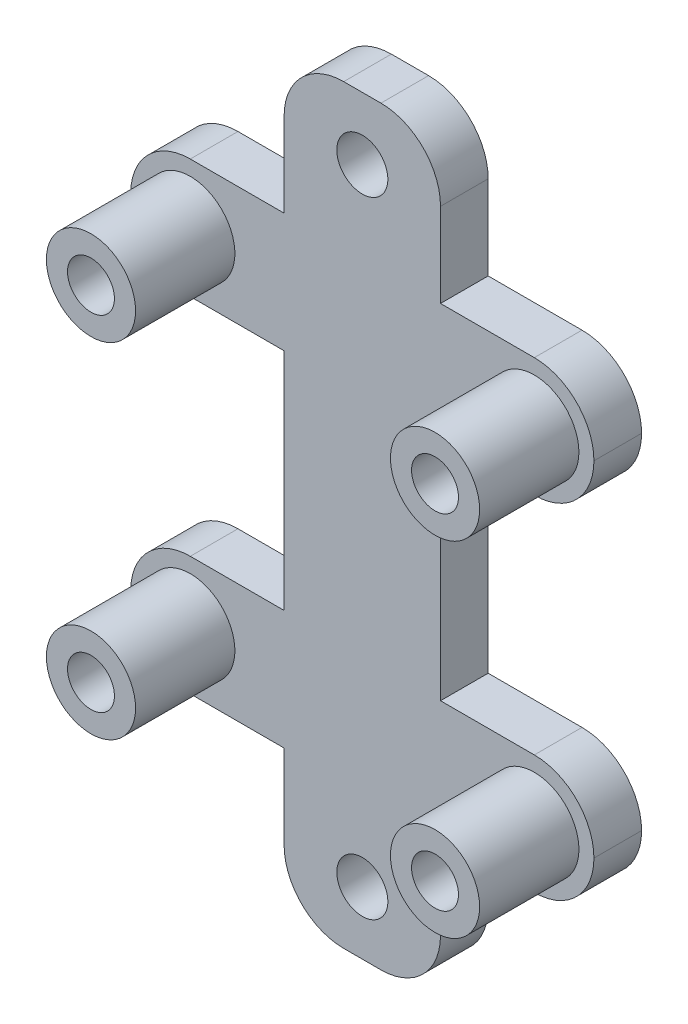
SolidWorks part; units mm, degrees
ref_plane "Front Plane" through (0, 0, 0) normal (0, 0, 1) x (1, 0, 0)
ref_plane "Top Plane" through (0, 0, 0) normal (0, 1, 0) x (1, 0, 0)
ref_plane "Right Plane" through (0, 0, 0) normal (1, 0, 0) x (0, 0, -1)
sketch "Sketch1" plane through (0, 0, 0) normal (0, 0, 1) x (1, 0, 0)
  line L0 (29.62, 30.6567) -> (19.81, 30.6567)
  line L5 (19.81, 30.6567) -> (19.81, 39.8467)
  line L6 (19.81, 39.8467) -> (9.81, 39.8467)
  line L7 (9.81, 39.8467) -> (9.81, 30.6567)
  line L8 (0, 30.6567) -> (9.81, 30.6567)
  line L14 (0, 15.8467) -> (29.62, 15.8467) construction
  line L16 (14.81, 15.8467) -> (14.81, 35.8467) construction
  line L17 (0, 30.6567) -> (0, 23.0367)
  line L18 (0, 23.0367) -> (9.81, 23.0367)
  line L22 (29.62, 30.6567) -> (29.62, 23.0367)
  line L23 (29.62, 23.0367) -> (19.81, 23.0367)
  line L27 (3.81, 26.8467) -> (14.81, 26.8467) construction
  line L28 (14.81, 26.8467) -> (25.81, 26.8467) construction
  line L29 (3.81, 26.8467) -> (3.81, 15.8467) construction
  line L31 (14.81, 35.8467) -> (14.81, 39.8467) construction
  line L32 (25.81, 26.8467) -> (25.81, 30.6567) construction
  line L33 (9.81, 23.0367) -> (9.81, 15.8467)
  line L34 (25.81, 26.8467) -> (25.81, 23.0367) construction
  line L35 (25.81, 26.8467) -> (29.62, 26.8467) construction
  line L36 (9.81, 15.8467) -> (19.81, 15.8467)
  line L37 (19.81, 15.8467) -> (19.81, 23.0367)
  circle A0 centre (14.81, 35.8467) radius 1.6319
  circle A3 centre (3.81, 26.8467) radius 1.5
  circle A4 centre (25.81, 26.8467) radius 1.5
  circle A7 centre (3.81, 26.8467) radius 3.81 construction
  dimension "D7" = 3.2639
  dimension "D8" = 3
  dimension "D2" = 7.62
  dimension "D1" = 24
  dimension "D3" = 5
  dimension "D4" = 11
  dimension "D5" = 11
  dimension "D6" = 20
extrude "Boss-Extrude1" add sketch "Sketch1" along normal blind 3.048
mirror "Mirror2" about plane through (9.81, 15.8467, 3.048) normal (0, 1, 0) of "Boss-Extrude1"
sketch "Sketch2" plane through (0, 0, 3.048) normal (0, 0, 1) x (1, 0, 0)
  circle A0 centre (3.81, 26.8467) radius 2.85
  circle A1 centre (25.81, 26.8467) radius 2.85
  circle A4 centre (3.81, 26.8467) radius 1.5
  circle A5 centre (25.81, 26.8467) radius 1.5
  circle A8 centre (3.81, 4.8467) radius 2.85
  circle A9 centre (25.81, 4.8467) radius 2.85
  circle A10 centre (25.81, 4.8467) radius 1.5
  circle A11 centre (3.81, 4.8467) radius 1.5
  dimension "D2" = 22
extrude "Boss-Extrude2" add sketch "Sketch2" along normal blind 6.35
fillet "Fillet5" radius 3.81 1 edges at (0, 30.6567, 1.524)
fillet "Fillet6" radius 3.81 3 edges at (0, 24.9417, 0) (0, 24.9417, 3.048) (0, 23.0367, 1.524)
fillet "Fillet7" radius 3.81 1 edges at (0, 8.6567, 1.524)
fillet "Fillet8" radius 3.81 3 edges at (0, 2.9417, 0) (0, 1.0367, 1.524) (0, 2.9417, 3.048)
fillet "Fillet9" radius 3.81 1 edges at (29.62, 30.6567, 1.524)
fillet "Fillet10" radius 3.81 3 edges at (29.62, 24.9417, 0) (29.62, 23.0367, 1.524) (29.62, 24.9417, 3.048)
fillet "Fillet11" radius 3.81 1 edges at (29.62, 8.6567, 1.524)
fillet "Fillet12" radius 3.81 3 edges at (29.62, 2.9417, 0) (29.62, 2.9417, 3.048) (29.62, 1.0367, 1.524)
fillet "Fillet13" radius 3.81 1 edges at (9.81, 39.8467, 1.524)
fillet "Fillet14" radius 3.81 1 edges at (19.81, 39.8467, 1.524)
fillet "Fillet15" radius 3.81 1 edges at (9.81, -8.1533, 1.524)
fillet "Fillet16" radius 3.81 1 edges at (19.81, -8.1533, 1.524)
